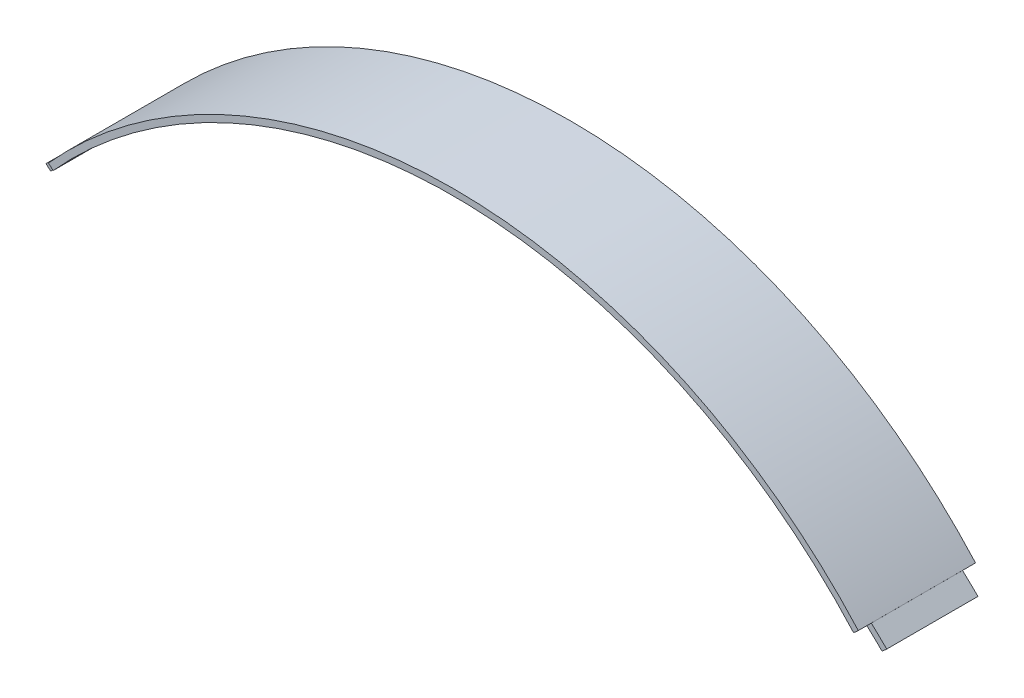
SolidWorks part; units mm, degrees
ref_plane "Plan de face" through (0, 0, 0) normal (0, 0, 1) x (1, 0, 0)
ref_plane "Plan de dessus" through (0, 0, 0) normal (0, 1, 0) x (1, 0, 0)
ref_plane "Plan de droite" through (0, 0, 0) normal (1, 0, 0) x (0, 0, -1)
sketch "Esquisse1" plane through (0, 0, 0) normal (0, 0, 1) x (1, 0, 0)
  line L0 (-4.7165, 0) -> (560, 0) construction
  line L1 (0, -3.7385) -> (0, 120) construction
  line L2 (15, 114.3956) -> (15, 97.5684) construction
  line L3 (-7.953, 110) -> (560, 110) construction
  line L4 (86.6027, 30) -> (55.8673, 30) construction
  line L5 (75, 116.2615) -> (75, -3.7385) construction
  line L6 (10.1933, 107) -> (560, 107) construction
  line L7 (70, 30) -> (30.5013, 119.453) construction
  line L8 (70, 53.6115) -> (70, 10.5132) construction
  line L9 (44.3629, 20) -> (500, 20) construction
  line L10 (259.9961, -148.7006) -> (450, 22.4077) construction
  line L11 (505, 114.3956) -> (505, 97.5684) construction
  line L12 (502, 116.837) -> (502, 100.6853) construction
  line L13 (450, 30) -> (489.4987, 119.453) construction
  line L14 (445, 116.2615) -> (445, -3.7385) construction
  line L15 (450, 53.6115) -> (450, 10.5132) construction
  line L17 (260.0062, -148.5757) -> (70, 22.3939) construction
  line L18 (70, 22.3939) -> (72.1892, 20.424)
  line L19 (450, 22.4077) -> (447.8004, 20.4269)
  line L33 (260, 136.814) -> (260, -36.3206) construction
  line L35 (520, -36.3206) -> (520, 152.0013) construction
  line L52 (-7.4882, 113) -> (22.5674, 113) construction
  line L54 (18, 116.837) -> (18, 100.6853) construction
  line L65 (238.4381, 104) -> (285, 104) construction
  line L78 (69.1744, 17.979) -> (200.5959, 118.8222) construction
  line L79 (192.0307, 89.3528) -> (171.4801, 116.135) construction
  line L80 (197.7035, 89.7409) -> (182.9039, 109.0281) construction
  line L81 (182.9039, 109.0281) -> (68.4039, 21.1692) construction
  line L82 (188, 100.0122) -> (188, 115.2683) construction
  line L85 (180, 115.2683) -> (180, 95.6918) construction
  line L92 (450.8256, 17.979) -> (319.4041, 118.8222) construction
  line L93 (337.0961, 109.0281) -> (451.5961, 21.1692) construction
  arc A0 (70, 22.3939) -> (450, 22.4077) centre (260.0062, -148.5757) cw
  arc A2 (72.1892, 20.424) -> (447.8004, 20.4269) centre (259.9961, -148.7006) cw
  dimension "D9" = 3
  dimension "D6" = 165
  dimension "D7" = 3
  dimension "D10" = 3
  dimension "D12" = 37.5
  dimension "D13" = 8
extrude "Extrusion1" add sketch "Esquisse1" along normal blind 55
ref_plane "Plan1" through (0, 0, 27.5) normal (0, 0, 1) x (1, 0, 0)
sketch "Esquisse3" plane through (0, 0, 27.5) normal (0, 0, 1) x (1, 0, 0)
  line L0 (79.6802, 31.6329) -> (61.5785, 14.3724) construction
  line L1 (60.1703, 17.8058) -> (68.6098, 10.174) construction
  line L2 (74.5456, 18.2887) -> (65.7558, 26.2372) construction
  line L3 (64.6185, 13.195) -> (73.6682, 21.8242) construction
  line L4 (62.7411, 15.481) -> (64.9351, 13.4969)
  line L5 (64.9351, 13.4969) -> (72.1892, 20.424)
  line L6 (72.1892, 20.424) -> (70, 22.3939)
  line L7 (70, 22.3939) -> (62.7411, 15.481)
  line L8 (260, 120.5262) -> (260, -4.3561) construction
  line L9 (457.2589, 15.481) -> (455.0649, 13.4969)
  line L10 (450, 22.3939) -> (457.2589, 15.481)
  line L11 (447.8108, 20.424) -> (450, 22.3939)
  line L12 (455.0649, 13.4969) -> (447.8108, 20.424)
  dimension "D1" = 2.95
  dimension "D2" = 10
extrude "Extrusion2" add sketch "Esquisse3" along normal mid plane 42.8
